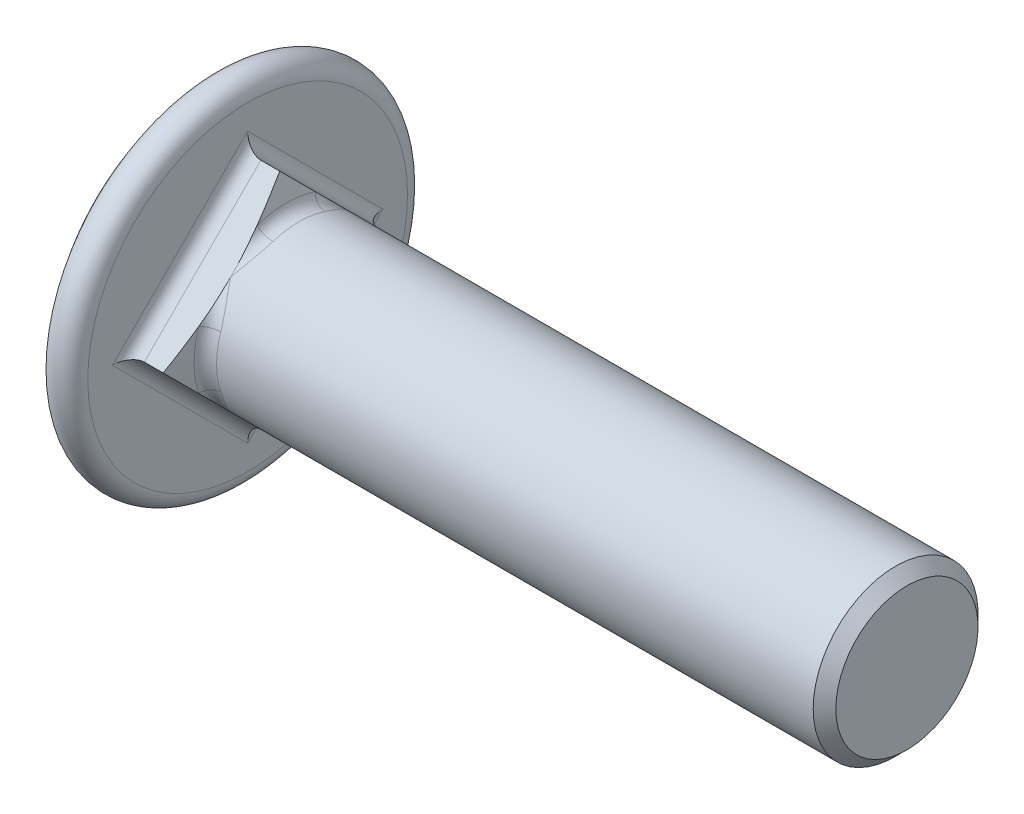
SolidWorks part; units mm, degrees
ref_plane "Plane1" through (0, 0, 0) normal (0, 0, 1) x (1, 0, 0)
ref_plane "Plane2" through (0, 0, 0) normal (0, 1, 0) x (1, 0, 0)
ref_plane "Plane3" through (0, 0, 0) normal (1, 0, 0) x (0, 0, -1)
sketch "BodySke" plane through (0, 0, 0) normal (0, 0, 1) x (1, 0, 0)
  line L0 (8.8, 19.4) -> (8.8, 21.5) construction
  line L1 (6.7, 21.5) -> (10.9, 21.5) construction
  line L2 (10.9, 19.4) -> (10.9, 10)
  line L3 (10.9, 10) -> (89.526, 10)
  line L4 (90.9, 8.626) -> (90.9, 0)
  line L5 (90.9, 0) -> (0, 0)
  line L6 (-31.75, 0) -> (127, 0) construction
  line L8 (90.9, 8.626) -> (89.526, 10)
  line L10 (90.9, -8.626) -> (89.526, -10) construction
  line L11 (13.4, 7.799) -> (13.4, 1.449) construction
  line L12 (30.9, 7.799) -> (30.9, 1.449) construction
  line L13 (30.9, 7.799) -> (30.9, 1.449) construction
  arc A0 (7.1476, 20.6959) -> (0, 0) centre (33.5366, 0) ccw
  arc A1 (10.9, 19.4) -> (7.1476, 20.6959) centre (8.8, 19.4) ccw
  dimension "Diameter" = 20
  dimension "Head_ht" = 10.9
  dimension "Length" = 80
  dimension "Body_ch_ang" = 45
  dimension "Head_dia" = 43
  dimension "Minor_dia" = 17.252
  dimension "Advance" = 2.5
  dimension "Thread_nom" = 60
  dimension "Thread_length" = 60
  dimension "HeadContour" = 4.2
revolve "Base-Revolve" add sketch "BodySke" angle 360 about L6
sketch "Sketch1" plane through (10.9, 0, 0) normal (1, 0, 0) x (0, 0, -1)
  line L0 (0, 14.1421) -> (14.1421, 0)
  line L1 (14.1421, 0) -> (0, -14.1421)
  line L2 (0, -14.1421) -> (-14.1421, 0)
  line L3 (-14.1421, 0) -> (0, 14.1421)
  circle A0 centre (0, 0) radius 10 construction
  dimension "D1" = 20
extrude "Boss-Extrude1" add sketch "Sketch1" along normal blind 5
sketch "Sketch2" plane through (0, 0, 0) normal (0, 0, 1) x (1, 0, 0)
  line L0 (0, 0) -> (101.6, 0) construction
  line L1 (15.9, 10) -> (20.9, 10)
  line L2 (15.9, 10) -> (12.5506, 22.5)
  line L3 (20.9, 10) -> (20.9, 22.5)
  line L4 (20.9, 22.5) -> (12.5506, 22.5)
  dimension "D1" = 20
  dimension "D2" = 15.9
  dimension "D3" = 45
  dimension "D4" = 5
  dimension "D5" = 15
revolve "Cut-Revolve1" cut sketch "Sketch2" angle 360 about L0
fillet "Fillet1" radius 1.6 4 edges at (10.9, 7.0711, -7.0711) (10.9, -7.0711, -7.0711) (10.9, 7.0711, 7.0711) (10.9, -7.0711, 7.0711)
fillet "Fillet2" radius 1.6 4 edges at (15.9, 0, 10) (15.9, 10, 0) (15.9, 0, -10) (15.9, -10, 0)
sketch "ThdSchSke" plane through (0, 0, 0) normal (0, 0, 1) x (1, 0, 0)
  line L0 (30.9, -8.626) -> (29.9379, -10)
  line L1 (30.9, -8.626) -> (31.8621, -10)
  line L2 (31.8621, -10) -> (31.8621, -12.5)
  line L3 (0, 0) -> (5.1513, 0) construction
  line L4 (-31.75, 0) -> (127, 0) construction
  line L5 (31.8621, -12.5) -> (29.9379, -12.5)
  line L6 (29.9379, -12.5) -> (29.9379, -10)
  arc A1 (7.1476, 20.6959) -> (7.1476, -20.6959) centre (33.5366, 0) ccw construction
  dimension "Thread_minor" = 17.252
  dimension "Diameter" = 20
  dimension "Start" = 30.9
  dimension "SideAngle" = 55
  dimension "VeeAngle" = 70
  dimension "Overcut" = 25
revolve "ThreadSchematic" [suppressed] cut sketch "ThdSchSke" angle 360 about L3
pattern_linear "ThdSchPat" [suppressed]
equation "\"Thread_minor@ThreadCosmetic\"  =  \"Minor_dia@BodySke\""
equation "\"Thread_length@ThreadCosmetic\" = ((sgn( (\"Length@BodySke\" - \"Advance@BodySke\" * 3.0) - \"Thread_nom@BodySke\" )-1)*( (\"Length@BodySke\" - \"Advance@BodySke\" * 3.0) - \"Thread_nom@BodySke\" ))/-2+ \"Thread_no"
equation "\"Thread_minor@ThdSchSke\" = \"Minor_dia@BodySke\""
equation "\"Diameter@ThdSchSke\" = \"Diameter@BodySke\""
equation "\"Overcut@ThdSchSke\" = \"Diameter@BodySke\" * 1.25"
equation "\"Start@ThdSchSke\" = \"Head_ht@BodySke\" + \"Length@BodySke\" - \"Thread_length@ThreadCosmetic\"  '---Non-countersunk---"
equation "\"Num_threads@ThdSchPat\" = int( \"Thread_length@ThreadCosmetic\" / \"Advance@BodySke\" + 0.999 )  + 1"
equation "\"Advance@ThdSchPat\" = \"Thread_length@ThreadCosmetic\" /  (\"Num_threads@ThdSchPat\" - 1) 'relax it"
equation "\"Num_threads@ThdSchPat\" = \"Num_threads@ThdSchPat\" - sgn( \"Num_threads@ThdSchPat\" - 1) '---chamfered tips only---"
equation "\"D1@Sketch2\" = \"Diameter@Bodyske\""
equation "\"D2@Sketch2\" = \"Head_ht@Bodyske\" + \"NeckHt@Boss-extrude1\""
equation "\"D3@Sketch2\" = \"Head_dia@Bodyske\" + 2"
equation "\"D1@Sketch1\" = \"Diameter@Bodyske\""
equation "\"D1@Fillet2\" = \"HeadFilletRad@Fillet1\""
